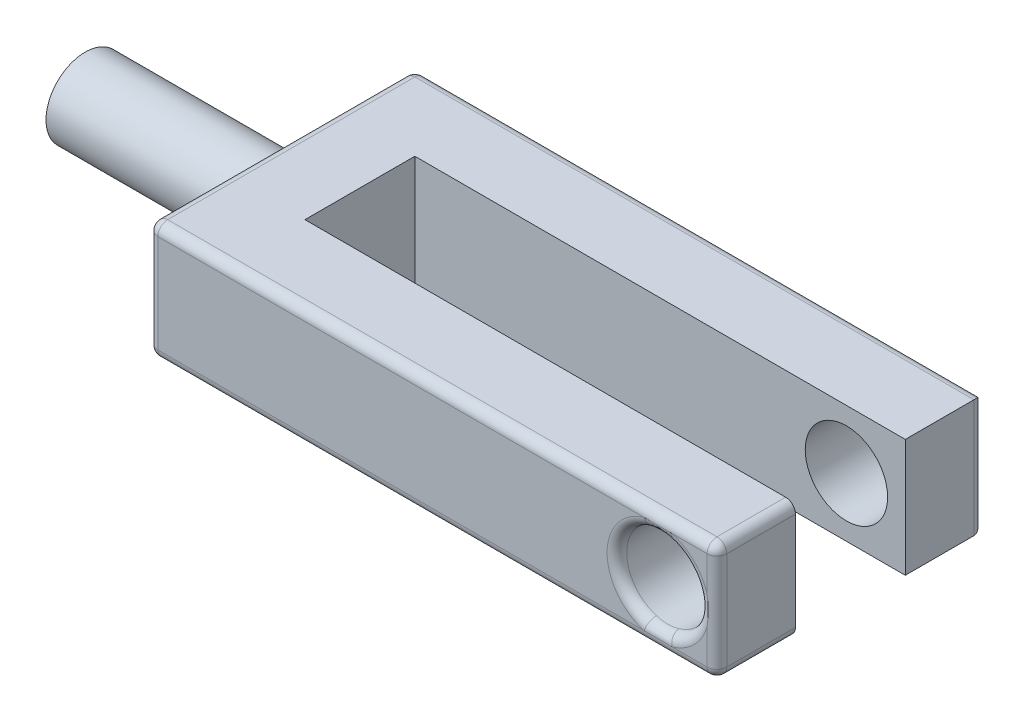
SolidWorks part; units mm, degrees
ref_plane "Front Plane" through (0, 0, 0) normal (0, 0, 1) x (1, 0, 0)
ref_plane "Top Plane" through (0, 0, 0) normal (0, 1, 0) x (1, 0, 0)
ref_plane "Right Plane" through (0, 0, 0) normal (1, 0, 0) x (0, 0, -1)
sketch "Sketch2" plane through (0, 0, 0) normal (0, 1, 0) x (1, 0, 0)
  line L0 (25, -5.6) -> (25, -13.6)
  line L5 (-25, -5.6) -> (25, -5.6)
  line L6 (-25, -5.6) -> (-25, 5.6)
  line L7 (-25, 5.6) -> (25, 5.6)
  line L15 (-33, 13.6) -> (25, 13.6)
  line L17 (-33, -13.6) -> (25, -13.6)
  line L18 (25, 13.6) -> (25, 5.6)
  line L21 (-33, 13.6) -> (-33, -13.6)
  point P0 (0, 0)
  point P1 (0, 0)
  point P7 (-25, 0)
  dimension "D1" = 50
  dimension "D2" = 11.2
  dimension "D3" = 27.2
  dimension "D4" = 8
extrude "Boss-Extrude1" add sketch "Sketch2" along normal mid plane 12
sketch "Sketch3" plane through (0, 0, 13.6) normal (0, 0, 1) x (1, 0, 0)
  line L0 (25, 6) -> (25, -6) construction
  line L1 (-33, -6) -> (25, -6) construction
  circle A0 centre (19, 0) radius 4.2
  dimension "D3" = 8.4
  dimension "D1" = 6
  dimension "D2" = 6
extrude "Cut-Extrude1" cut sketch "Sketch3" against normal through all contours A0
sketch "Sketch4" plane through (-33, 0, 0) normal (-1, 0, 0) x (0, 0, 1)
  circle A0 centre (0, 0) radius 4
  dimension "D1" = 8
extrude "Boss-Extrude2" add sketch "Sketch4" along normal blind 20 contours A0
fillet "Fillet1" radius 1 1 edges at (-4, 6, 13.6)
fillet "Fillet2" radius 1 3 edges at (-33, -0.5, 13.6) (-33, 5.7071, 13.3071) (-33, 6, -0.5)
fillet "Fillet3" radius 1 3 edges at (-33, -6, -0.5) (-32.7071, -6, 13.3071) (-3.5, -6, 13.6)
fillet "Fillet4" radius 1 7 edges at (25, 0, -13.6) (-3.5, 6, -13.6) (-32.7071, 5.7071, -13.6) (-33, 0, -13.6) (-32.7071, -5.7071, -13.6) (-3.5, -6, -13.6) (23.2, 0, -13.6)
fillet "Fillet5" radius 1 6 edges at (25, 6, 9.1) (25, 5.7071, 13.3071) (25, -6, 9.1) (25, -5.7071, 13.3071) (25, 0, 13.6) (23.2, 0, 13.6)
